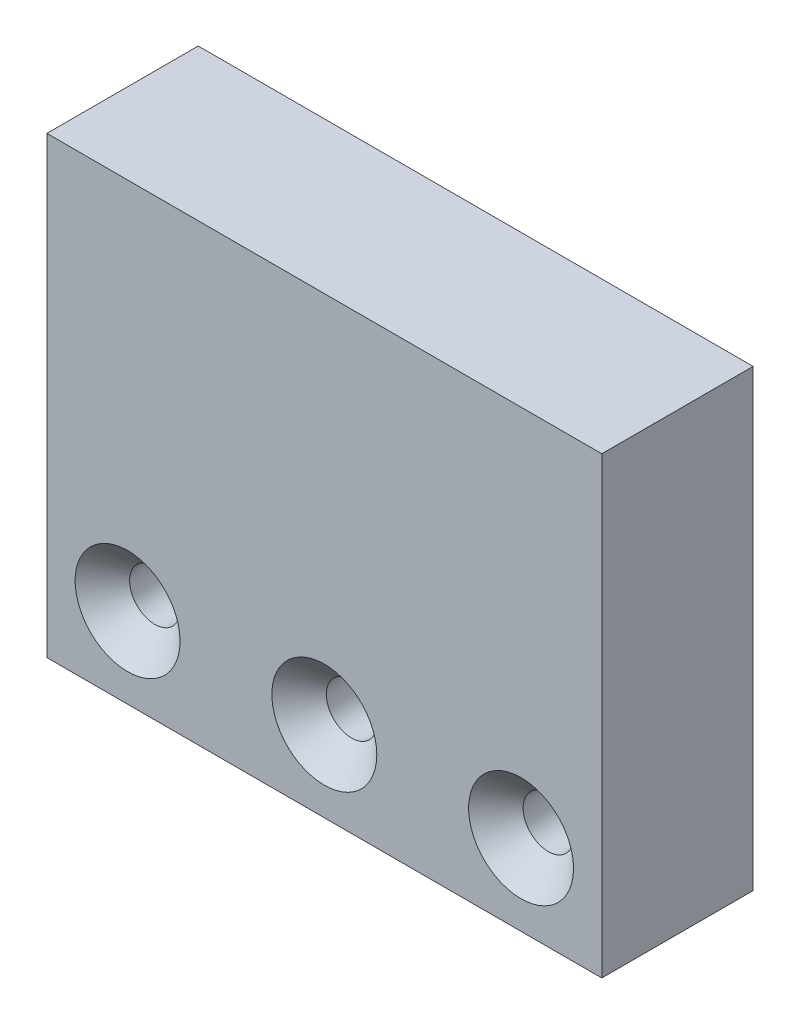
SolidWorks part; units mm, degrees
ref_plane "Front Plane" through (0, 0, 0) normal (0, 0, 1) x (1, 0, 0)
ref_plane "Top Plane" through (0, 0, 0) normal (0, 1, 0) x (1, 0, 0)
ref_plane "Right Plane" through (0, 0, 0) normal (1, 0, 0) x (0, 0, -1)
sketch "Sketch1" plane through (0, 0, 0) normal (0, 0, 1) x (1, 0, 0)
  line L1 (-27.5, -22.5) -> (27.5, -22.5)
  line L2 (-27.5, -22.5) -> (-27.5, 22.5)
  line L3 (-27.5, 22.5) -> (27.5, 22.5)
  line L4 (27.5, -22.5) -> (27.5, 22.5)
  line L5 (-27.5, -22.5) -> (27.5, 22.5) construction
  line L6 (-27.5, 22.5) -> (27.5, -22.5) construction
  point P0 (0, 0)
  dimension "D1" = 55
  dimension "D2" = 45
extrude "Boss-Extrude1" add sketch "Sketch1" along normal blind 15
sketch "Sketch2" plane through (0, 0, 15) normal (0, 0, 1) x (1, 0, 0)
  line L2 (-27.5, 22.5) -> (-27.5, -22.5) construction
  line L3 (-27.5, -22.5) -> (27.5, -22.5) construction
  point P0 (-19.5, -14.5)
  point P1 (-38.9757, -2.0753)
  point P8 (0, -14.5)
  point P9 (19.5, -14.5)
  dimension "D3" = 3
  dimension "D4" = 19.5
  dimension "D1" = 8
  dimension "D2" = 8
sketch "Sketch3" plane through (0, 0, 0) normal (0, 0, -1) x (-1, 0, 0)
  line L0 (-27.5, -22.5) -> (-27.5, 22.5) construction
  line L1 (-27.5, 22.5) -> (27.5, 22.5) construction
  line L2 (27.5, 22.5) -> (27.5, -22.5) construction
  point P0 (-15.5, 13.5)
  point P1 (15.5, 13.5)
  dimension "D1" = 12
  dimension "D2" = 9
  dimension "D3" = 12
  dimension "D4" = 9
hole_wizard "M5x0.8 Tapped Hole1" positions "3DSketch1" profile "Sketch4" tap size "M5x0.8" standard "ANSI Metric"
sketch3d "3DSketch1"
  point P0 (15.5, 13.5, 0)
  point P3 (-15.5, 13.5, 0)
sketch "Sketch4" plane through (15.5, 13.5, 0) normal (1, 0, 0) x (0, 1, 0)
  line L0 (0, 0) -> (0, 11.2618)
  line L1 (0, 11.2618) -> (2.1, 10)
  line L2 (2.1, 10) -> (2.1, 0)
  line L5 (2.1, 0) -> (0, 0)
  line L10 (0, 11.2618) -> (-2.1, 10) construction
  line L11 (0, -6.35) -> (0, 107.95) construction
  dimension "Tap Drill Dia." = 4.2
  dimension "Tap Drill Depth" = 10
  dimension "Drill Angle" = 118
hole_wizard "CSK for M5 Flat Head Machine Screw1" positions "3DSketch2" profile "Sketch6" countersink size "M5" standard "ANSI Metric"
sketch3d "3DSketch2"
  point P0 (-19.5, -14.5, 15)
  point P3 (0, -14.5, 15)
  point P6 (19.5, -14.5, 15)
sketch "Sketch6" plane through (-19.5, -14.5, 15) normal (1, 0, 0) x (0, -1, 0)
  line L0 (0, 0) -> (0, 15)
  line L1 (0, 15) -> (2.5, 15)
  line L2 (2.5, 15) -> (2.5, 2.7)
  line L3 (2.5, 2.7) -> (5.2, 0)
  line L5 (5.2, 0) -> (0, 0)
  line L6 (-2.5, 2.7) -> (-5.2, 0) construction
  line L11 (0, -6.35) -> (0, 107.95) construction
  dimension "Thru Hole Dia." = 5
  dimension "Thru Hole Depth" = 15
  dimension "Near C'Sink Dia." = 10.4
  dimension "Near C'Sink Angle" = 90
